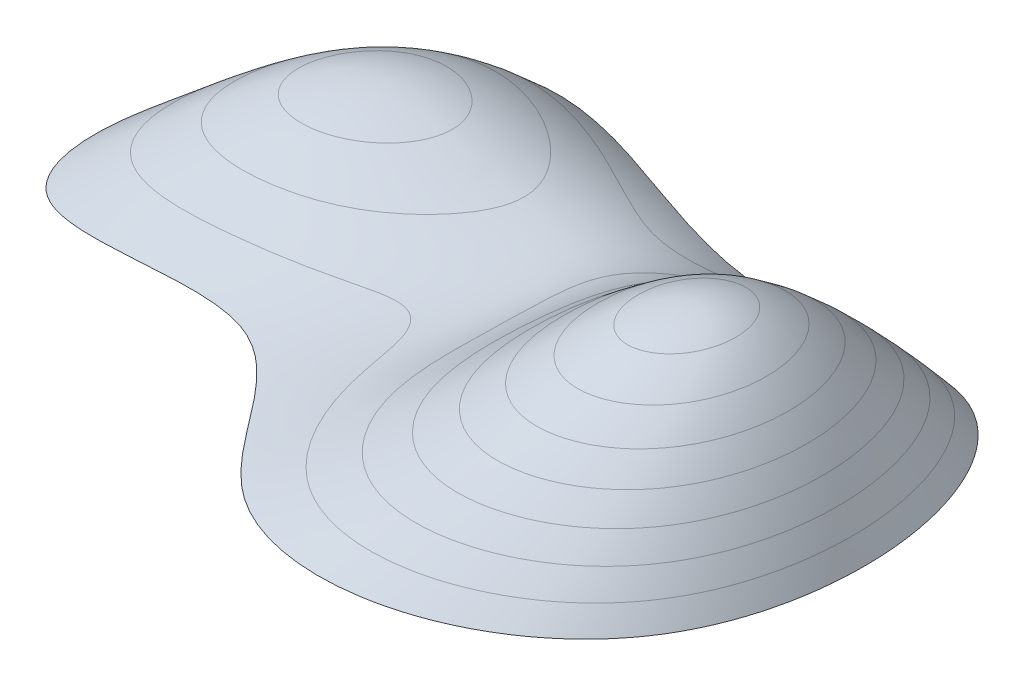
SolidWorks part; units mm, degrees
ref_plane "Ebene vorne" through (0, 0, 0) normal (0, 0, 1) x (1, 0, 0)
ref_plane "Ebene oben" through (0, 0, 0) normal (0, 1, 0) x (1, 0, 0)
ref_plane "Ebene rechts" through (0, 0, 0) normal (1, 0, 0) x (0, 0, -1)
sketch "Skizze1" plane through (0, 0, 0) normal (0, 1, 0) x (1, 0, 0)
  spline S0 degree 3 poles (-306.0573, -191.4336) (-269.0692, 77.4802) (-99.5033, 243.4032) (108.8149, 81.4892) (400.8571, 192.4007) (467.4069, -256.7482) (66.4653, -358.437) (-28.0389, -87.7158) (-306.0573, -191.4336) (-269.0692, 77.4802) (-99.5033, 243.4032) knots -0.314582 -0.21319 -0.107404 0 0.087169 0.245253 0.3387 0.516491 0.685418 0.78681 0.892596 1 1.087169 1.245253 1.3387 only from (-245.3717, 70.411) to (-245.3717, 70.411)
sketch3d "3D-Skizze1"
  point P0 (-135.484, 69.754, -24.9342)
  point P1 (84.5035, 34.5925, 55.3492)
  point P2 (284.6723, 149.9614, 60.2862)
surface "Oberflächenausfüllung1"
sketch "Skizze2" plane through (0, 0, 0) normal (0, 1, 0) x (1, 0, 0)
  line L1 (-327.068, 218.1916) -> (448.6467, 218.1916)
  line L2 (-327.068, 218.1916) -> (-327.068, -352.4189)
  line L3 (-327.068, -352.4189) -> (448.6467, -352.4189)
  line L4 (448.6467, 218.1916) -> (448.6467, -352.4189)
extrude "Aufsatz-Linear austragen1" add sketch "Skizze2" along normal blind 20
pattern_linear "Lineares Muster1" count 8 spacing 20 along (0, 1, 0)
other "Oberflächenschnitt1"
